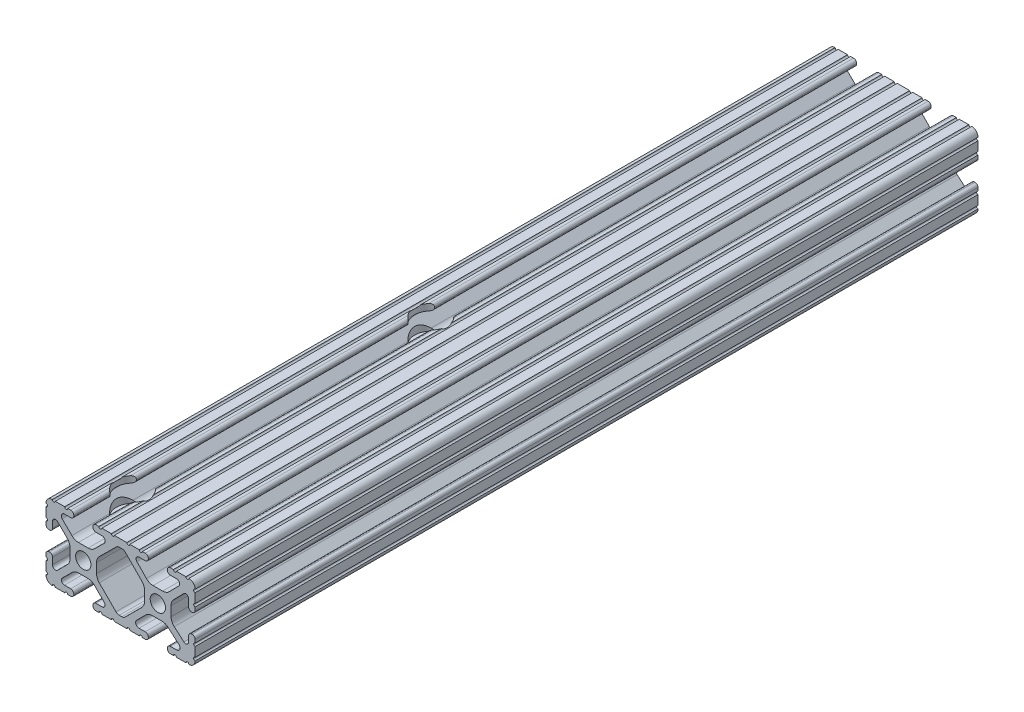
SolidWorks part; units mm, degrees
ref_plane "Front" through (0, 0, 0) normal (0, 0, 1) x (1, 0, 0)
ref_plane "Top" through (0, 0, 0) normal (0, 1, 0) x (1, 0, 0)
ref_plane "Right" through (0, 0, 0) normal (1, 0, 0) x (0, 0, -1)
sketch "Sketch1" plane through (0, 0, 0) normal (0, 0, 1) x (1, 0, 0)
  line L0 (-20.1324, -9.4742) -> (-5.2676, -9.4742) construction
  line L16 (-7.2595, -3.8694) -> (-1.5457, -9.5728)
  line L17 (-8.1915, 1.6223) -> (-8.1915, -1.6223)
  line L18 (-1.504, 9.5765) -> (-7.252, 3.8768)
  line L19 (0.5515, 10.033) -> (-0.3952, 10.033)
  line L20 (7.2829, 3.8459) -> (1.6756, 9.5611)
  line L21 (8.1915, -1.6223) -> (8.1915, 1.6223)
  line L22 (1.5457, -9.5728) -> (7.2595, -3.8694)
  line L23 (-0.4332, -10.033) -> (0.4332, -10.033)
  line L136 (18.0171, 12.7) -> (16.9875, 12.7)
  line L137 (15.9385, 11.651) -> (15.9385, 11.5392)
  line L138 (16.9875, 10.4902) -> (19.1164, 10.4902)
  line L139 (19.8441, 8.7652) -> (16.619, 5.4551)
  line L140 (14.3449, 4.4958) -> (11.0833, 4.4958)
  line L141 (8.817, 5.4472) -> (5.5642, 8.7627)
  line L142 (6.2894, 10.4902) -> (8.4125, 10.4902)
  line L143 (9.4615, 11.5392) -> (9.4615, 11.651)
  line L144 (8.4125, 12.7) -> (7.3829, 12.7)
  line L145 (6.3669, 12.7) -> (3.1496, 12.7)
  line L146 (2.1336, 12.7) -> (-2.1336, 12.7)
  line L147 (-3.1496, 12.7) -> (-6.3669, 12.7)
  line L148 (-7.3829, 12.7) -> (-8.4125, 12.7)
  line L149 (-9.4615, 11.651) -> (-9.4615, 11.5392)
  line L150 (-8.4125, 10.4902) -> (-6.2836, 10.4902)
  line L151 (-5.5326, 8.6661) -> (-8.81, 5.4163)
  line L152 (-11.0455, 4.4958) -> (-14.3545, 4.4958)
  line L153 (-16.59, 5.4163) -> (-19.8674, 8.6661)
  line L154 (-19.1164, 10.4902) -> (-16.9875, 10.4902)
  line L155 (-15.9385, 11.5392) -> (-15.9385, 11.651)
  line L156 (-16.9875, 12.7) -> (-18.0171, 12.7)
  line L157 (-19.0331, 12.7) -> (-22.2504, 12.7)
  line L158 (-25.4, 9.5504) -> (-25.4, 6.3331)
  line L159 (-25.4, 5.3171) -> (-25.4, 4.2375)
  line L160 (-24.401, 3.2385) -> (-24.2392, 3.2385)
  line L161 (-23.1902, 4.2875) -> (-23.1902, 6.3347)
  line L162 (-21.434, 7.0665) -> (-18.148, 3.8082)
  line L163 (-17.2085, 1.5536) -> (-17.2085, -1.6952)
  line L164 (-18.1405, -3.9423) -> (-21.4316, -7.2274)
  line L165 (-23.1902, -6.498) -> (-23.1902, -4.2875)
  line L166 (-24.2392, -3.2385) -> (-24.351, -3.2385)
  line L167 (-25.4, -4.2875) -> (-25.4, -5.3171)
  line L168 (-25.4, -6.3331) -> (-25.4, -9.5504)
  line L169 (-22.2504, -12.7) -> (-19.0331, -12.7)
  line L170 (-18.0171, -12.7) -> (-16.9875, -12.7)
  line L171 (-15.9384, -11.651) -> (-15.9384, -11.5392)
  line L172 (-16.9875, -10.4902) -> (-19.1164, -10.4902)
  line L173 (-19.8341, -8.7551) -> (-16.4966, -5.4237)
  line L174 (-14.2536, -4.4958) -> (-11.1464, -4.4958)
  line L175 (-8.9034, -5.4237) -> (-5.5659, -8.7551)
  line L176 (-6.2836, -10.4902) -> (-8.4125, -10.4902)
  line L177 (-9.4616, -11.5392) -> (-9.4616, -11.651)
  line L178 (-8.4125, -12.7) -> (-7.3829, -12.7)
  line L179 (-6.3669, -12.7) -> (-3.1496, -12.7)
  line L180 (-2.1336, -12.7) -> (2.1336, -12.7)
  line L181 (3.1496, -12.7) -> (6.3669, -12.7)
  line L182 (7.3829, -12.7) -> (8.4125, -12.7)
  line L183 (9.4616, -11.651) -> (9.4616, -11.5392)
  line L184 (8.4125, -10.4902) -> (6.2894, -10.4902)
  line L185 (5.4807, -8.5353) -> (8.5979, -5.4237)
  line L186 (10.8409, -4.4958) -> (14.1026, -4.4958)
  line L187 (16.1879, -5.2766) -> (19.8682, -8.4822)
  line L188 (19.1164, -10.4902) -> (16.9875, -10.4902)
  line L189 (15.9384, -11.5392) -> (15.9384, -11.651)
  line L190 (16.9875, -12.7) -> (18.0171, -12.7)
  line L191 (19.0331, -12.7) -> (22.2504, -12.7)
  line L192 (25.4, -9.5504) -> (25.4, -6.3331)
  line L193 (25.4, -5.3171) -> (25.4, -4.2375)
  line L194 (24.401, -3.2385) -> (24.1892, -3.2385)
  line L195 (23.1902, -4.2375) -> (23.1902, -6.1559)
  line L196 (21.584, -6.8869) -> (18.2982, -4.025)
  line L197 (17.2085, -1.6308) -> (17.2085, 1.6308)
  line L198 (18.1094, 3.8465) -> (21.5263, 7.3534)
  line L199 (23.1902, 6.6769) -> (23.1902, 4.2375)
  line L200 (24.1892, 3.2385) -> (24.401, 3.2385)
  line L201 (25.4, 4.2375) -> (25.4, 5.3171)
  line L202 (25.4, 6.3332) -> (25.4, 9.5504)
  line L203 (22.2504, 12.7) -> (19.0331, 12.7)
  circle A2 centre (-12.7, 0) radius 2.6035
  circle A4 centre (12.7, 0) radius 2.6035
  arc A18 (-1.5457, -9.5728) -> (-0.4332, -10.033) centre (-0.4332, -8.4582) ccw
  arc A19 (-8.1915, -1.6223) -> (-7.2595, -3.8694) centre (-5.0165, -1.6223) ccw
  arc A20 (-7.252, 3.8768) -> (-8.1915, 1.6223) centre (-5.0165, 1.6223) ccw
  arc A21 (-0.3952, 10.033) -> (-1.504, 9.5765) centre (-0.3952, 8.4582) ccw
  arc A22 (1.6756, 9.5611) -> (0.5515, 10.033) centre (0.5515, 8.4582) ccw
  arc A23 (8.1915, 1.6223) -> (7.2829, 3.8459) centre (5.0165, 1.6223) ccw
  arc A24 (7.2595, -3.8694) -> (8.1915, -1.6223) centre (5.0165, -1.6223) ccw
  arc A25 (0.4332, -10.033) -> (1.5457, -9.5728) centre (0.4332, -8.4582) ccw
  arc A152 (18.0171, 12.7) -> (19.0331, 12.7) centre (18.5251, 12.7) ccw
  arc A153 (16.9875, 12.7) -> (15.9385, 11.651) centre (16.9875, 11.651) ccw
  arc A154 (15.9385, 11.5392) -> (16.9875, 10.4902) centre (16.9875, 11.5392) ccw
  arc A155 (19.8441, 8.7652) -> (19.1164, 10.4902) centre (19.1164, 9.4742) ccw
  arc A156 (14.3449, 4.4958) -> (16.619, 5.4551) centre (14.3449, 7.6708) ccw
  arc A157 (8.817, 5.4472) -> (11.0833, 4.4958) centre (11.0833, 7.6708) ccw
  arc A158 (6.2894, 10.4902) -> (5.5642, 8.7627) centre (6.2894, 9.4742) ccw
  arc A159 (8.4125, 10.4902) -> (9.4615, 11.5392) centre (8.4125, 11.5392) ccw
  arc A160 (9.4615, 11.651) -> (8.4125, 12.7) centre (8.4125, 11.651) ccw
  arc A161 (6.3669, 12.7) -> (7.3829, 12.7) centre (6.8749, 12.7) ccw
  arc A162 (2.1336, 12.7) -> (3.1496, 12.7) centre (2.6416, 12.7) ccw
  arc A163 (-3.1496, 12.7) -> (-2.1336, 12.7) centre (-2.6416, 12.7) ccw
  arc A164 (-7.3829, 12.7) -> (-6.3669, 12.7) centre (-6.8749, 12.7) ccw
  arc A165 (-8.4125, 12.7) -> (-9.4615, 11.651) centre (-8.4125, 11.651) ccw
  arc A166 (-9.4615, 11.5392) -> (-8.4125, 10.4902) centre (-8.4125, 11.5392) ccw
  arc A167 (-5.5326, 8.6661) -> (-6.2836, 10.4902) centre (-6.2836, 9.4235) ccw
  arc A168 (-11.0455, 4.4958) -> (-8.81, 5.4163) centre (-11.0455, 7.6708) ccw
  arc A169 (-16.59, 5.4163) -> (-14.3545, 4.4958) centre (-14.3545, 7.6708) ccw
  arc A170 (-19.1164, 10.4902) -> (-19.8674, 8.6661) centre (-19.1164, 9.4235) ccw
  arc A171 (-16.9875, 10.4902) -> (-15.9385, 11.5392) centre (-16.9875, 11.5392) ccw
  arc A172 (-15.9385, 11.651) -> (-16.9875, 12.7) centre (-16.9875, 11.651) ccw
  arc A173 (-19.0331, 12.7) -> (-18.0171, 12.7) centre (-18.5251, 12.7) ccw
  arc A174 (-23.2664, 12.6998) -> (-22.2504, 12.7) centre (-22.7584, 12.7) ccw
  arc A175 (-23.2664, 12.6998) -> (-25.3998, 10.5664) centre (-23.2918, 10.5918) ccw
  arc A176 (-25.4, 9.5504) -> (-25.3998, 10.5664) centre (-25.4, 10.0584) ccw
  arc A177 (-25.4, 5.3171) -> (-25.4, 6.3331) centre (-25.4, 5.8251) ccw
  arc A178 (-25.4, 4.2375) -> (-24.401, 3.2385) centre (-24.401, 4.2375) ccw
  arc A179 (-24.2392, 3.2385) -> (-23.1902, 4.2875) centre (-24.2392, 4.2875) ccw
  arc A180 (-21.434, 7.0665) -> (-23.1902, 6.3347) centre (-22.1596, 6.3347) ccw
  arc A181 (-17.2085, 1.5536) -> (-18.148, 3.8082) centre (-20.3835, 1.5536) ccw
  arc A182 (-18.1405, -3.9423) -> (-17.2085, -1.6952) centre (-20.3835, -1.6952) ccw
  arc A183 (-23.1902, -6.498) -> (-21.4316, -7.2274) centre (-22.1596, -6.498) ccw
  arc A184 (-23.1902, -4.2875) -> (-24.2392, -3.2385) centre (-24.2392, -4.2875) ccw
  arc A185 (-24.351, -3.2385) -> (-25.4, -4.2875) centre (-24.351, -4.2875) ccw
  arc A186 (-25.4, -6.3331) -> (-25.4, -5.3171) centre (-25.4, -5.8251) ccw
  arc A187 (-25.3998, -10.5664) -> (-25.4, -9.5504) centre (-25.4, -10.0584) ccw
  arc A188 (-25.3998, -10.5664) -> (-23.2664, -12.6998) centre (-23.2918, -10.5918) ccw
  arc A189 (-22.2504, -12.7) -> (-23.2664, -12.6998) centre (-22.7584, -12.7) ccw
  arc A190 (-18.0171, -12.7) -> (-19.0331, -12.7) centre (-18.5251, -12.7) ccw
  arc A191 (-16.9875, -12.7) -> (-15.9384, -11.651) centre (-16.9875, -11.651) ccw
  arc A192 (-15.9384, -11.5392) -> (-16.9875, -10.4902) centre (-16.9875, -11.5392) ccw
  arc A193 (-19.8341, -8.7551) -> (-19.1164, -10.4902) centre (-19.1164, -9.4742) ccw
  arc A194 (-14.2536, -4.4958) -> (-16.4966, -5.4237) centre (-14.2536, -7.6708) ccw
  arc A195 (-8.9034, -5.4237) -> (-11.1464, -4.4958) centre (-11.1464, -7.6708) ccw
  arc A196 (-6.2836, -10.4902) -> (-5.5659, -8.7551) centre (-6.2836, -9.4742) ccw
  arc A197 (-8.4125, -10.4902) -> (-9.4616, -11.5392) centre (-8.4125, -11.5392) ccw
  arc A198 (-9.4616, -11.651) -> (-8.4125, -12.7) centre (-8.4125, -11.651) ccw
  arc A199 (-6.3669, -12.7) -> (-7.3829, -12.7) centre (-6.8749, -12.7) ccw
  arc A200 (-2.1336, -12.7) -> (-3.1496, -12.7) centre (-2.6416, -12.7) ccw
  arc A201 (3.1496, -12.7) -> (2.1336, -12.7) centre (2.6416, -12.7) ccw
  arc A202 (7.3829, -12.7) -> (6.3669, -12.7) centre (6.8749, -12.7) ccw
  arc A203 (8.4125, -12.7) -> (9.4616, -11.651) centre (8.4125, -11.651) ccw
  arc A204 (9.4616, -11.5392) -> (8.4125, -10.4902) centre (8.4125, -11.5392) ccw
  arc A205 (5.4807, -8.5353) -> (6.2894, -10.4902) centre (6.2894, -9.3455) ccw
  arc A206 (10.8409, -4.4958) -> (8.5979, -5.4237) centre (10.8409, -7.6708) ccw
  arc A207 (16.1879, -5.2766) -> (14.1026, -4.4958) centre (14.1026, -7.6708) ccw
  arc A208 (19.1164, -10.4902) -> (19.8682, -8.4822) centre (19.1164, -9.3455) ccw
  arc A209 (16.9875, -10.4902) -> (15.9384, -11.5392) centre (16.9875, -11.5392) ccw
  arc A210 (15.9384, -11.651) -> (16.9875, -12.7) centre (16.9875, -11.651) ccw
  arc A211 (19.0331, -12.7) -> (18.0171, -12.7) centre (18.5251, -12.7) ccw
  arc A212 (23.2664, -12.6998) -> (22.2504, -12.7) centre (22.7584, -12.7) ccw
  arc A213 (23.2664, -12.6998) -> (25.3998, -10.5664) centre (23.2918, -10.5918) ccw
  arc A214 (25.4, -9.5504) -> (25.3998, -10.5664) centre (25.4, -10.0584) ccw
  arc A215 (25.4, -5.3171) -> (25.4, -6.3331) centre (25.4, -5.8251) ccw
  arc A216 (25.4, -4.2375) -> (24.401, -3.2385) centre (24.401, -4.2375) ccw
  arc A217 (24.1892, -3.2385) -> (23.1902, -4.2375) centre (24.1892, -4.2375) ccw
  arc A218 (21.584, -6.8869) -> (23.1902, -6.1559) centre (22.2207, -6.1559) ccw
  arc A219 (17.2085, -1.6308) -> (18.2982, -4.025) centre (20.3835, -1.6308) ccw
  arc A220 (18.1094, 3.8465) -> (17.2085, 1.6308) centre (20.3835, 1.6308) ccw
  arc A221 (23.1902, 6.6769) -> (21.5263, 7.3534) centre (22.2207, 6.6769) ccw
  arc A222 (23.1902, 4.2375) -> (24.1892, 3.2385) centre (24.1892, 4.2375) ccw
  arc A223 (24.401, 3.2385) -> (25.4, 4.2375) centre (24.401, 4.2375) ccw
  arc A224 (25.4, 6.3332) -> (25.4, 5.3171) centre (25.4, 5.8251) ccw
  arc A225 (25.3998, 10.5664) -> (25.4, 9.5504) centre (25.4, 10.0584) ccw
  arc A226 (25.3998, 10.5664) -> (23.2664, 12.6998) centre (23.2918, 10.5918) ccw
  arc A227 (22.2504, 12.7) -> (23.2664, 12.6998) centre (22.7584, 12.7) ccw
extrude "Boss-Extrude1" add sketch "Sketch1" along normal mid plane 266.7
hole_wizard "CBORE for 1/4 Socket Head Cap Screw1" positions "Sketch2" profile "Sketch3" counterbore size "1/4" standard "ANSI Inch"
sketch "Sketch2" plane through (0, 12.7, 0) normal (0, 1, 0) x (1, 0, 0)
  point P0 (-12.7, -116.5352)
  point P3 (-12.7, -14.9352)
sketch "Sketch3" plane through (-12.7, 12.7, 116.5352) normal (1, 0, 0) x (0, 0, 1)
  line L0 (0, 0) -> (0, 25.4)
  line L1 (0, 25.4) -> (3.3782, 25.4)
  line L3 (3.3782, 25.4) -> (3.3782, 8.2042)
  line L4 (3.3782, 8.2042) -> (5.5562, 8.2042)
  line L5 (5.5562, 8.2042) -> (5.5562, 0)
  line L7 (5.5562, 0) -> (0, 0)
  line L11 (0, -6.35) -> (0, 107.95) construction
  dimension "Thru Hole Dia." = 6.7564
  dimension "Thru Hole Depth" = 25.4
  dimension "C'Bore Dia." = 11.1125
  dimension "C'Bore Depth" = 8.2042
